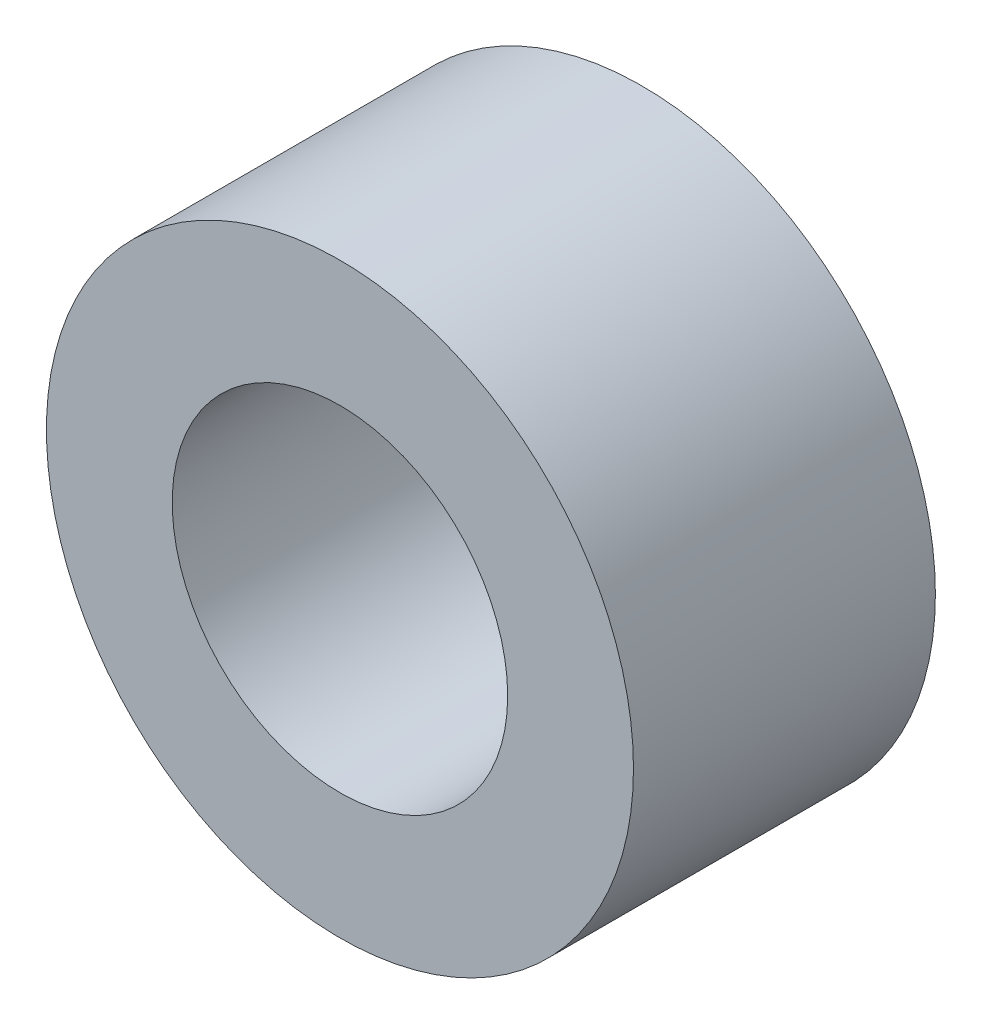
SolidWorks part; units mm, degrees
ref_plane "Plan de face" through (0, 0, 0) normal (0, 0, 1) x (1, 0, 0)
ref_plane "Plan de dessus" through (0, 0, 0) normal (0, 1, 0) x (1, 0, 0)
ref_plane "Plan de droite" through (0, 0, 0) normal (1, 0, 0) x (0, 0, -1)
sketch "Esquisse1" plane through (0, 0, 0) normal (0, 0, 1) x (1, 0, 0)
  circle A0 centre (0, 0) radius 1
  circle A1 centre (0, 0) radius 1 construction
  circle A2 centre (0, 0) radius 1.75
  dimension "D1" = 3.5
extrude "Boss.-Extru.1" add sketch "Esquisse1" along normal blind 1.8
